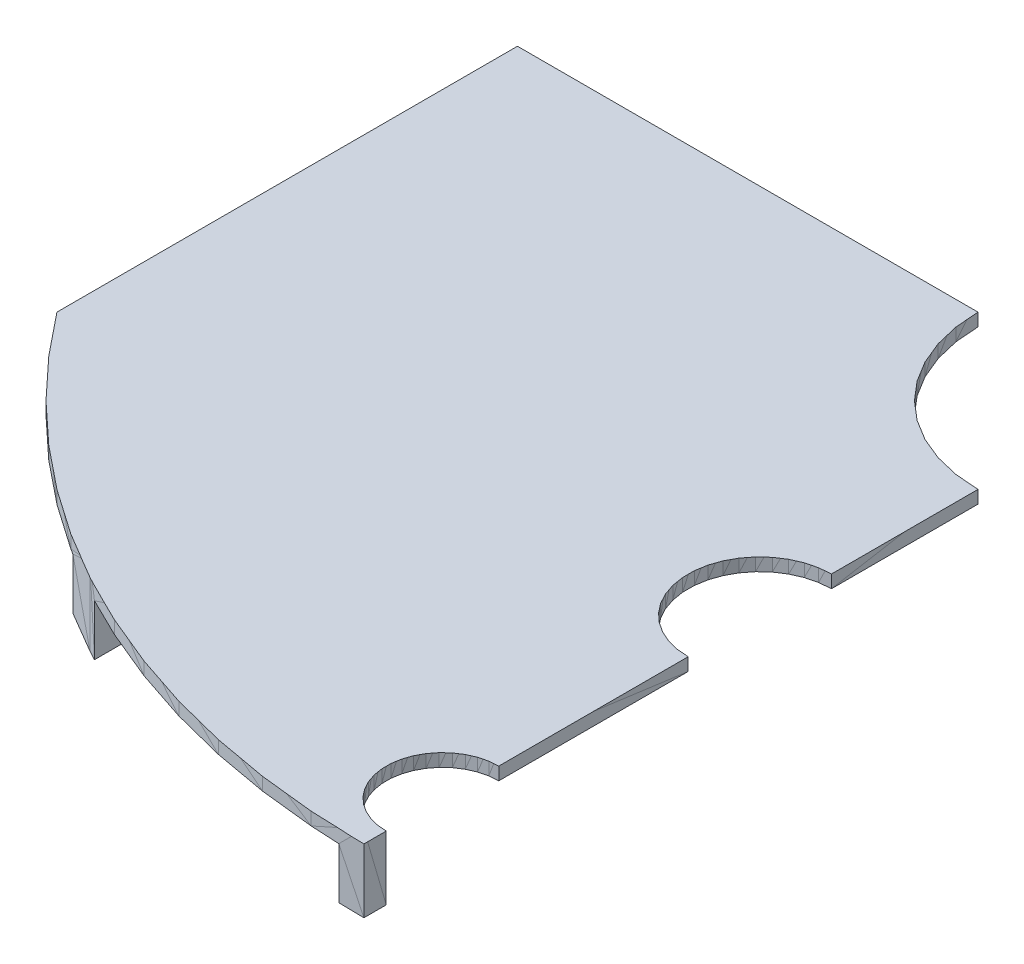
SolidWorks part; units mm, degrees
ref_plane "Front Plane" through (0, 0, 0) normal (0, 0, 1) x (1, 0, 0)
ref_plane "Top Plane" through (0, 0, 0) normal (0, 1, 0) x (1, 0, 0)
ref_plane "Right Plane" through (0, 0, 0) normal (1, 0, 0) x (0, 0, -1)
imported_body "Imported1"
sketch "Sketch1" plane through (0, 10, 0) normal (0, -1, 0) x (1, 0, 0)
  line L0 (70, 120.9339) -> (0, 0) construction
  line L1 (-25.1158, 131.1561) -> (30, 131.1561)
  line L2 (-25.1158, 131.1561) -> (-25.1158, -122.7181)
  line L3 (-25.1158, -122.7181) -> (30, -122.7181)
  line L4 (30, 131.1561) -> (30, -122.7181)
  line L5 (-25.1158, 131.1561) -> (30, -122.7181) construction
  line L6 (-25.1158, -122.7181) -> (30, 131.1561) construction
  line L7 (150, 123.6406) -> (150, 86.6406) construction
  point P0 (2.4421, 4.219)
  dimension "D1" = 120
extrude "Cut-Extrude1" cut sketch "Sketch1" against normal through all
sketch "Sketch2" plane through (150, 0, 0) normal (1, 0, 0) x (0, 0, -1)
  line L0 (-86.6406, 15) -> (-123.6406, 15) construction
  line L1 (-231.0376, 15) -> (13.2698, 15)
  line L2 (-231.0376, 15) -> (-231.0376, 12.5)
  line L3 (-231.0376, 12.5) -> (13.2698, 12.5)
  line L4 (13.2698, 15) -> (13.2698, 12.5)
  line L5 (-231.0376, 15) -> (13.2698, 12.5) construction
  line L6 (-231.0376, 12.5) -> (13.2698, 15) construction
  point P0 (-108.8839, 13.75)
  dimension "D1" = 2.5
extrude "Cut-Extrude2" cut sketch "Sketch2" against normal through all
